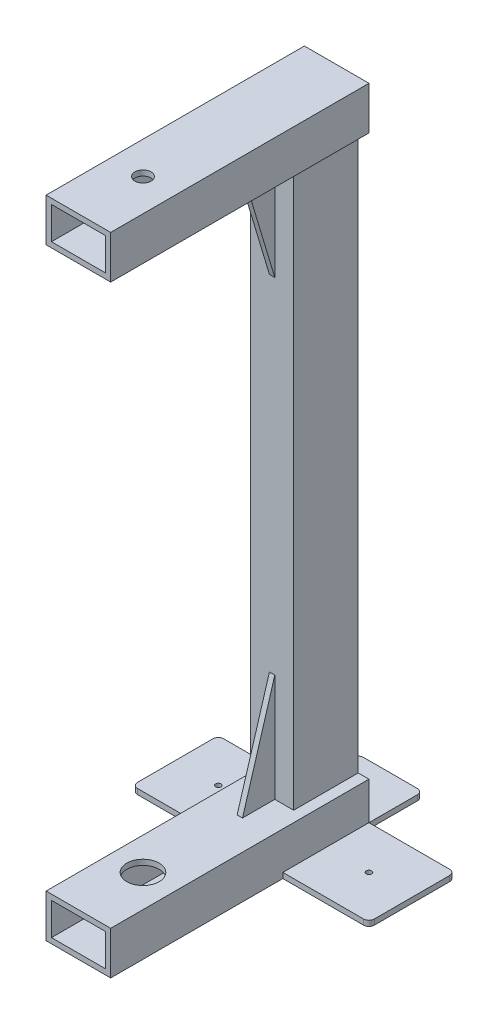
SolidWorks part; units mm, degrees
ref_plane "Front Plane" through (0, 0, 0) normal (0, 0, 1) x (1, 0, 0)
ref_plane "Top Plane" through (0, 0, 0) normal (0, 1, 0) x (1, 0, 0)
ref_plane "Right Plane" through (0, 0, 0) normal (1, 0, 0) x (0, 0, -1)
sketch "Sketch1" plane through (0, 0, 0) normal (0, 0, 1) x (1, 0, 0)
  line L1 (-25.4, -330.2) -> (25.4, -330.2)
  line L2 (-25.4, -330.2) -> (-25.4, 330.2)
  line L3 (-25.4, 330.2) -> (25.4, 330.2)
  line L4 (25.4, -330.2) -> (25.4, 330.2)
  line L5 (-25.4, -330.2) -> (25.4, 330.2) construction
  line L6 (-25.4, 330.2) -> (25.4, -330.2) construction
  point P0 (0, 0)
  dimension "D1" = 660.4
  dimension "D2" = 50.8
extrude "Boss-Extrude1" add sketch "Sketch1" along normal blind 76.2
sketch "Sketch8" plane through (0, 330.2, 0) normal (0, 1, 0) x (1, 0, 0)
  line L8 (19.05, -6.35) -> (-19.05, -6.35)
  line L9 (-19.05, -6.35) -> (-19.05, -69.85)
  line L10 (-19.05, -69.85) -> (19.05, -69.85)
  line L11 (19.05, -69.85) -> (19.05, -6.35)
  line L12 (19.05, -6.35) -> (-19.05, -6.35)
  line L13 (-19.05, -6.35) -> (-19.05, -69.85)
  line L14 (-19.05, -69.85) -> (19.05, -69.85)
  line L15 (19.05, -69.85) -> (19.05, -6.35)
  dimension "D1" = 6.35
extrude "Cut-Extrude3" cut sketch "Sketch8" against normal through all
sketch "Sketch2" plane through (0, 0, 0) normal (0, 0, -1) x (-1, 0, 0)
  line L0 (-25.4, 330.2) -> (25.4, 330.2) construction
  line L1 (-38.1, 330.2) -> (38.1, 330.2)
  line L2 (-38.1, 330.2) -> (-38.1, 381)
  line L3 (-38.1, 381) -> (38.1, 381)
  line L4 (38.1, 330.2) -> (38.1, 381)
  line L5 (-38.1, 330.2) -> (38.1, 381) construction
  line L6 (-38.1, 381) -> (38.1, 330.2) construction
  line L7 (25.4, -330.2) -> (-25.4, -330.2) construction
  line L8 (-38.1, -381) -> (38.1, -381)
  line L9 (-38.1, -381) -> (-38.1, -330.2)
  line L10 (-38.1, -330.2) -> (38.1, -330.2)
  line L11 (38.1, -381) -> (38.1, -330.2)
  line L12 (-38.1, -381) -> (38.1, -330.2) construction
  line L13 (-38.1, -330.2) -> (38.1, -381) construction
  point P4 (0, 355.6)
  point P7 (0, 0)
  point P13 (0, -355.6)
  dimension "D1" = 76.2
  dimension "D2" = 50.8
extrude "Boss-Extrude2" add sketch "Sketch2" against normal blind 304.8 separate body
sketch "Sketch9" plane through (0, 0, 304.8) normal (0, 0, 1) x (1, 0, 0)
  line L8 (31.75, 336.55) -> (31.75, 374.65)
  line L9 (31.75, 374.65) -> (-31.75, 374.65)
  line L10 (-31.75, 374.65) -> (-31.75, 336.55)
  line L11 (-31.75, 336.55) -> (31.75, 336.55)
  line L12 (31.75, 336.55) -> (31.75, 374.65)
  line L13 (31.75, 374.65) -> (-31.75, 374.65)
  line L14 (-31.75, 374.65) -> (-31.75, 336.55)
  line L15 (-31.75, 336.55) -> (31.75, 336.55)
  dimension "D1" = 6.35
extrude "Cut-Extrude4" cut sketch "Sketch9" against normal through all
sketch "Sketch3" plane through (0, 0, 0) normal (1, 0, 0) x (0, 0, -1)
  line L0 (-114.3, 330.2) -> (-76.2, 330.2)
  line L1 (-304.8, 330.2) -> (0, 330.2) construction
  line L2 (-76.2, 330.2) -> (-76.2, 203.2)
  line L3 (-76.2, -330.2) -> (-76.2, 330.2) construction
  line L4 (-76.2, 203.2) -> (-114.3, 330.2)
  line L5 (-114.3, -330.2) -> (-76.2, -330.2)
  line L6 (-304.8, -330.2) -> (0, -330.2) construction
  line L7 (-76.2, 330.2) -> (-76.2, -330.2) construction
  line L8 (-76.2, -330.2) -> (-76.2, -203.2)
  line L9 (-76.2, -203.2) -> (-114.3, -330.2)
  dimension "D1" = 127
  dimension "D2" = 38.1
extrude "Boss-Extrude3" add sketch "Sketch3" along normal blind 3.175 and the other way blind 3.175 separate body
sketch "Sketch4" plane through (0, -381, 0) normal (0, -1, 0) x (1, 0, 0)
  line L0 (-139.7, 101.6) -> (-38.1, 101.6)
  line L1 (-139.7, 0) -> (139.7, 0) construction
  line L2 (-139.7, 0) -> (-139.7, 101.6)
  line L3 (-139.7, 101.6) -> (139.7, 101.6) construction
  line L4 (139.7, 0) -> (139.7, 101.6)
  line L5 (-139.7, 0) -> (139.7, 101.6) construction
  line L6 (-139.7, 101.6) -> (139.7, 0) construction
  line L7 (-38.1, 101.6) -> (-38.1, 0)
  line L8 (-38.1, 0) -> (-139.7, 0)
  line L9 (38.1, 101.6) -> (139.7, 101.6)
  line L10 (38.1, 304.8) -> (38.1, 0) construction
  line L11 (38.1, 101.6) -> (38.1, 0)
  line L12 (38.1, 0) -> (139.7, 0)
  line L13 (-38.1, 304.8) -> (-38.1, 0) construction
  point P4 (0, 50.8)
  point P8 (0, 0)
  dimension "D1" = 101.6
  dimension "D2" = 101.6
extrude "Boss-Extrude4" add sketch "Sketch4" against normal blind 6.35
sketch "Sketch7" plane through (0, 0, 304.8) normal (0, 0, 1) x (1, 0, 0)
  line L8 (31.75, -374.65) -> (31.75, -336.55)
  line L9 (31.75, -336.55) -> (-31.75, -336.55)
  line L10 (-31.75, -336.55) -> (-31.75, -374.65)
  line L11 (-31.75, -374.65) -> (31.75, -374.65)
  line L12 (31.75, -374.65) -> (31.75, -336.55)
  line L13 (31.75, -336.55) -> (-31.75, -336.55)
  line L14 (-31.75, -336.55) -> (-31.75, -374.65)
  line L15 (-31.75, -374.65) -> (31.75, -374.65)
  dimension "D1" = 6.35
extrude "Cut-Extrude2" cut sketch "Sketch7" against normal through all
sketch "Sketch6" plane through (0, -330.2, 0) normal (0, 1, 0) x (1, 0, 0)
  line L0 (-38.1, -304.8) -> (38.1, -304.8) construction
  line L1 (0, -228.6) -> (0, -304.8) construction
  circle A0 centre (0, -228.6) radius 19.05
  dimension "D2" = 38.1
  dimension "D1" = 76.2
extrude "Cut-Extrude1" cut sketch "Sketch6" against normal up to next (6.35 mm away)
sketch "Sketch10" plane through (0, -381, 0) normal (0, -1, 0) x (1, 0, 0)
  line L0 (139.7, 0) -> (-139.7, 0) construction
  line L1 (-38.1, 0) -> (38.1, 0)
  line L2 (-38.1, 0) -> (-38.1, -63.5)
  line L3 (-38.1, -63.5) -> (38.1, -63.5)
  line L4 (38.1, 0) -> (38.1, -63.5)
  line L5 (-38.1, 0) -> (38.1, -63.5) construction
  line L6 (-38.1, -63.5) -> (38.1, 0) construction
  line L7 (-38.1, 304.8) -> (-38.1, 101.6) construction
  line L8 (38.1, 304.8) -> (38.1, 101.6) construction
  point P4 (0, -31.75)
  dimension "D1" = 63.5
extrude "Boss-Extrude5" add sketch "Sketch10" against normal up to surface (6.35 mm away)
sketch "Sketch11" plane through (0, 381, 0) normal (0, 1, 0) x (1, 0, 0)
  circle A1 centre (0, -228.6) radius 9.525
  dimension "D1" = 19.05
extrude "Cut-Extrude5" cut sketch "Sketch11" against normal up to surface (50.8 mm away)
sketch "Sketch12" plane through (0, -374.65, 0) normal (0, 1, 0) x (1, 0, 0)
  line L0 (-139.7, 0) -> (-38.1, -101.6) construction
  line L1 (-139.7, -101.6) -> (-38.1, 0) construction
  line L2 (-38.1, 0) -> (38.1, 63.5) construction
  line L3 (-38.1, 63.5) -> (38.1, 0) construction
  line L4 (31.75, 0) -> (38.1, 0) construction
  line L5 (38.1, 0) -> (38.1, 63.5) construction
  line L6 (139.7, 0) -> (38.1, -101.6) construction
  line L7 (38.1, 0) -> (139.7, -101.6) construction
  circle A0 centre (-88.9, -50.8) radius 3.175
  circle A1 centre (0, 31.75) radius 3.175
  circle A2 centre (88.9, -50.8) radius 3.175
  dimension "D1" = 6.35
extrude "Cut-Extrude6" cut sketch "Sketch12" against normal through all and the other way through all
fillet "Fillet1" radius 6.35 6 edges at (-139.7, -377.825, 0) (-38.1, -377.825, -63.5) (38.1, -377.825, -63.5) (139.7, -377.825, 0) (139.7, -377.825, 101.6) (-139.7, -377.825, 101.6)
